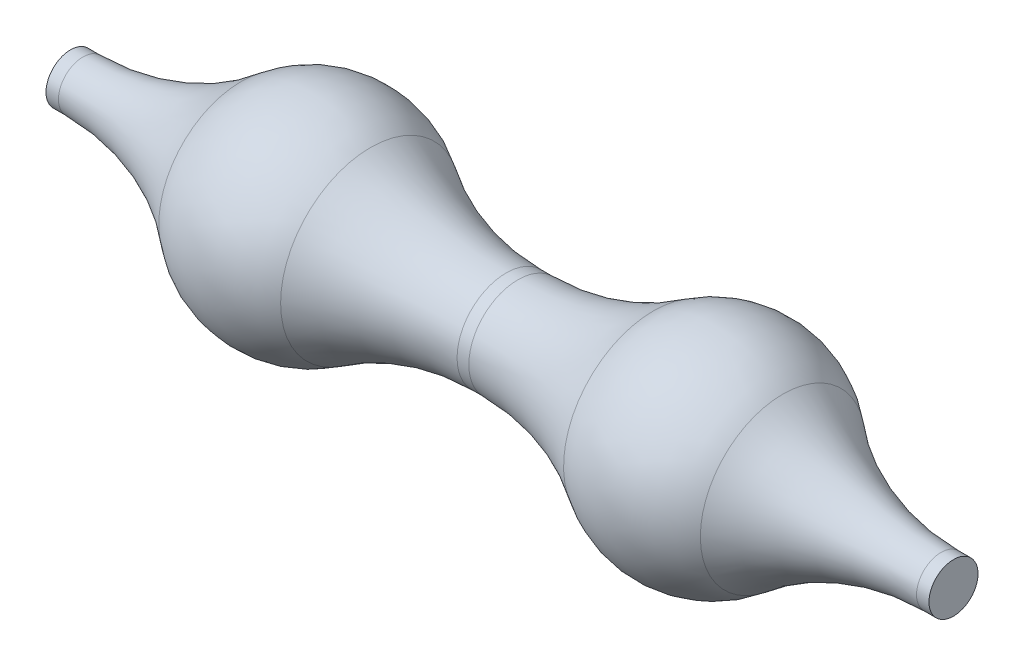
SolidWorks part; units mm, degrees
ref_plane "Front" through (0, 0, 0) normal (0, 0, 1) x (1, 0, 0)
ref_plane "Top" through (0, 0, 0) normal (0, 1, 0) x (1, 0, 0)
ref_plane "Right" through (0, 0, 0) normal (1, 0, 0) x (0, 0, -1)
sketch "Sketch1" plane through (0, 0, 0) normal (0, 0, 1) x (1, 0, 0)
  line L0 (-1.35, 0) -> (6.3, 0)
  line L1 (-1.35, 0.25) -> (0.0288, 0.25)
  line L2 (6.2712, 0.25) -> (7.65, 0.25)
  line L5 (7.65, 0) -> (7.65, 0.25)
  line L6 (2.0798, 0.5) -> (4.2202, 0.5)
  line L7 (-1.35, 0) -> (-1.35, 0.25)
  line L8 (0, 0.5) -> (6.3, 0.5) construction
  line L9 (0, 0.25) -> (6.3, 0.25) construction
  line L10 (0, 0) -> (6.3, 0) construction
  line L11 (6.3, 0) -> (7.65, 0)
  arc A0 (6.2712, 0.25) -> (4.2202, 0.5) centre (5.2, 0) ccw
  arc A1 (2.0798, 0.5) -> (0.0288, 0.25) centre (1.1, 0) ccw
revolve "Revolve1" add sketch "Sketch1" angle 360 about L0
fillet "Fillet1" radius 2.5 4 edges at (0.0288, 0, 0.25) (4.2202, 0, 0.5) (6.2712, 0, 0.25) (2.0798, 0, 0.5)
